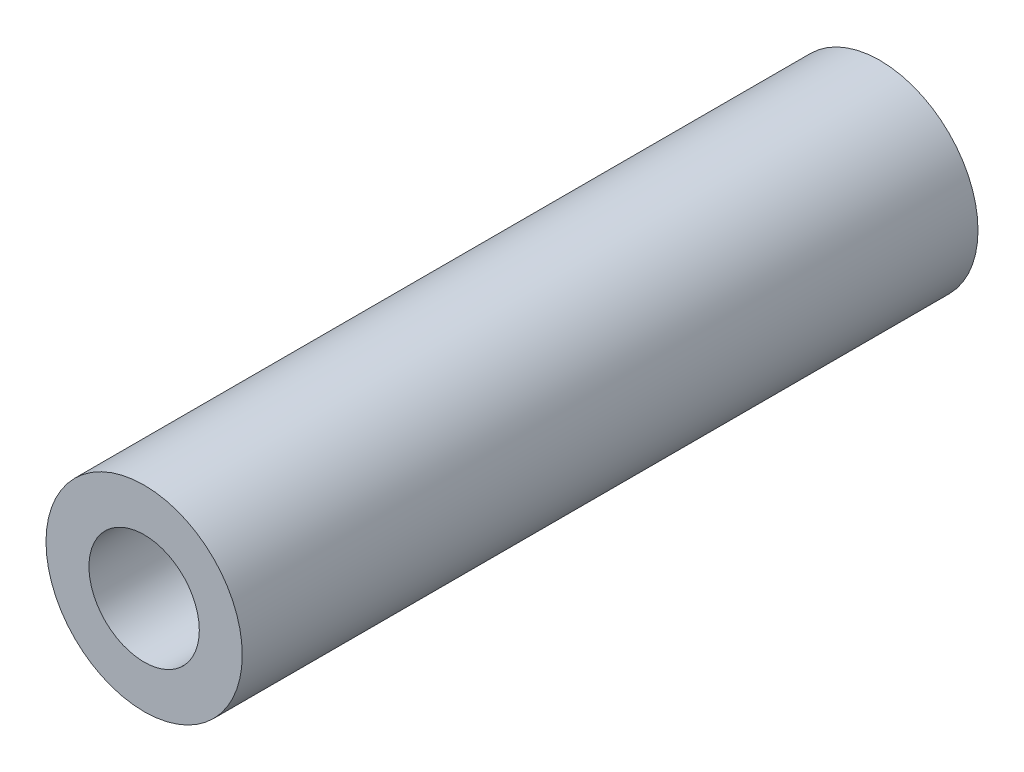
SolidWorks part; units mm, degrees
ref_plane "Front" through (0, 0, 0) normal (0, 0, 1) x (1, 0, 0)
ref_plane "Top" through (0, 0, 0) normal (0, 1, 0) x (1, 0, 0)
ref_plane "Right" through (0, 0, 0) normal (1, 0, 0) x (0, 0, -1)
sketch "Sketch1" plane through (0, 0, 0) normal (0, 0, 1) x (1, 0, 0)
  circle A0 centre (0, 0) radius 6.7754
  circle A1 centre (0, 0) radius 3.81
  dimension "外径" = 13.5509
  dimension "内径" = 7.62
extrude "Base-Extrude" add sketch "Sketch1" along normal blind 50.8
